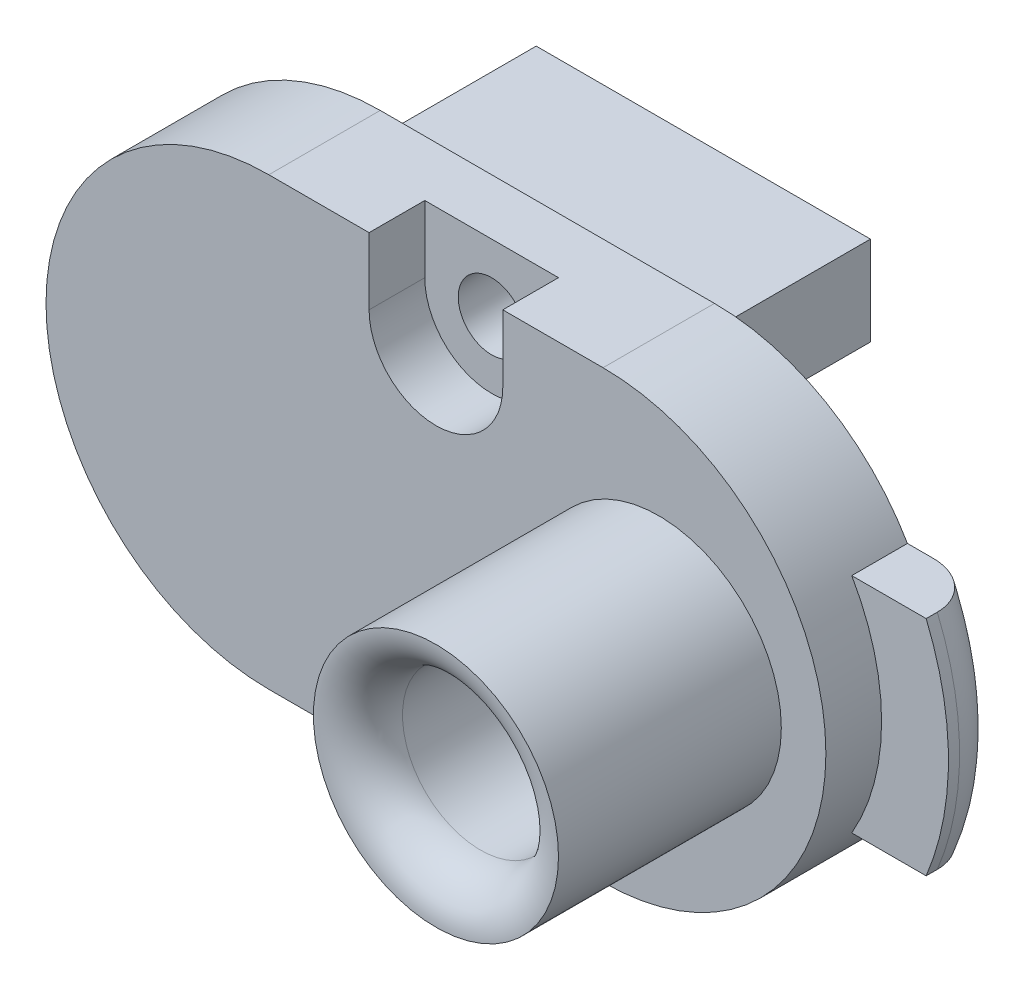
SolidWorks part; units mm, degrees
ref_plane "Face" through (0, 0, 0) normal (0, 0, 1) x (1, 0, 0)
ref_plane "Dessus" through (0, 0, 0) normal (0, 1, 0) x (1, 0, 0)
ref_plane "Droite" through (0, 0, 0) normal (1, 0, 0) x (0, 0, -1)
sketch "Esquisse1" plane through (0, 0, 0) normal (0, 0, 1) x (1, 0, 0)
  line L0 (-7.5, 0) -> (7.5, 0) construction
  line L1 (-7.5, 10) -> (7.5, 10)
  line L2 (-7.5, -10) -> (7.5, -10)
  arc A0 (7.5, -10) -> (7.5, 10) centre (7.5, 0) ccw
  arc A1 (-7.5, 10) -> (-7.5, -10) centre (-7.5, 0) ccw
  dimension "D1" = 35
  dimension "D2" = 10
extrude "Base-Extrusion" add sketch "Esquisse1" along normal mid plane 5
sketch "Esquisse3" plane through (0, 0, -2.5) normal (0, 0, -1) x (-1, 0, 0)
  line L0 (7.5, 9) -> (7.5, -9)
  line L1 (-7.5, -9) -> (-7.5, 9)
  line L14 (-7.5, -9) -> (7.5, -9)
  line L15 (7.5, 9) -> (-7.5, 9)
  line L16 (-7.5, -9) -> (7.5, -9)
  line L17 (7.5, 9) -> (-7.5, 9)
  arc A4 (-7.5, 9) -> (-7.5, -9) centre (-7.5, 0) ccw
  arc A5 (7.5, -9) -> (7.5, 9) centre (7.5, 0) ccw
  dimension "D1" = 1
extrude "Boss.-Extru.1" add sketch "Esquisse3" along normal blind 7
sketch "Esquisse2" plane through (0, 0, 2.5) normal (0, 0, 1) x (1, 0, 0)
  line L0 (3, -7) -> (3, -10)
  line L1 (-3, -7) -> (-3, -10)
  line L2 (0, -7) -> (0, 0) construction
  line L3 (-7.5, -10) -> (7.5, -10) construction
  line L4 (-3, -10) -> (3, -10)
  line L5 (0, 0) -> (14.475, 0) construction
  line L6 (-3, 10) -> (3, 10)
  line L7 (-3, 7) -> (-3, 10)
  line L8 (3, 7) -> (3, 10)
  arc A0 (3, 7) -> (-3, 7) centre (0, 7) cw
  arc A1 (3, -7) -> (-3, -7) centre (0, -7) ccw
  dimension "D1" = 6
  dimension "D2" = 3
extrude "Enlèv. mat.-Extru.1" cut sketch "Esquisse2" against normal blind 2.5
sketch "Esquisse4" plane through (0, 0, 0) normal (0, 0, 1) x (1, 0, 0)
  circle A0 centre (0, 7) radius 1.5
  circle A1 centre (0, -7) radius 1.5
  dimension "D1" = 3
extrude "Enlèv. mat.-Extru.2" cut sketch "Esquisse4" against normal through all
sketch "Esquisse5" plane through (0, 0, -9.5) normal (0, 0, -1) x (-1, 0, 0)
  line L0 (7.5, -9) -> (7.5, 9) construction
  line L1 (7.5, -5) -> (-7.5, -5)
  line L2 (7.5, -5) -> (7.5, 5)
  line L3 (7.5, 5) -> (-7.5, 5)
  line L4 (-7.5, -5) -> (-7.5, 5)
  line L5 (-7.5, 9) -> (-7.5, -9) construction
  line L6 (-7.5, 0) -> (0, 0) construction
  line L7 (-7.5, 10) -> (7.5, 10) construction
  dimension "D1" = 5
extrude "Enlèv. mat.-Extru.3" cut sketch "Esquisse5" against normal blind 5
sketch "Esquisse6" plane through (0, 0, -2.5) normal (0, 0, -1) x (-1, 0, 0)
  line L0 (7.5, -9) -> (7.5, 9) construction
  line L1 (7.5, -9) -> (7.5, -0.5)
  line L2 (7.5, 0.5) -> (16.4861, 0.5)
  line L3 (7.5, -0.5) -> (16.4861, -0.5)
  line L4 (7.5, 0.5) -> (7.5, 9)
  arc A0 (7.5, 9) -> (16.4861, 0.5) centre (7.5, 0) cw
  arc A1 (16.4861, -0.5) -> (7.5, -9) centre (7.5, 0) cw
  dimension "D1" = 1
extrude "Enlèv. mat.-Extru.5" cut sketch "Esquisse6" against normal blind 2
sketch "Esquisse7" plane through (0, 0, 2.5) normal (0, 0, 1) x (1, 0, 0)
  line L0 (0, 0) -> (10, 0) construction
  circle A0 centre (10, 0) radius 5.5
  arc A2 (7.5, -10) -> (7.5, 10) centre (7.5, 0) ccw construction
  dimension "D1" = 11
  dimension "D2" = 2
extrude "Boss.-Extru.2" add sketch "Esquisse7" along normal blind 10
sketch "Esquisse8" plane through (0, 0, 12.5) normal (0, 0, 1) x (1, 0, 0)
  circle A0 centre (10, 0) radius 3.5
  dimension "D1" = 7
extrude "Enlèv. mat.-Extru.6" cut sketch "Esquisse8" against normal through all
sketch "Esquisse9" plane through (0, 0, -9.5) normal (0, 0, -1) x (-1, 0, 0)
  circle A0 centre (-10, 0) radius 5.5
  dimension "D1" = 11
extrude "Enlèv. mat.-Extru.7" cut sketch "Esquisse9" against normal up to surface (7 mm away)
sketch "Esquisse10" plane through (0, 0, 0) normal (0, 0, 1) x (1, 0, 0)
  line L0 (16.1603, 5) -> (19.5, 5)
  line L1 (16.1603, -5) -> (19.5, -5)
  arc A0 (7.5, -10) -> (7.5, 10) centre (7.5, 0) ccw construction
  arc A1 (16.1603, -5) -> (16.1603, 5) centre (7.5, 0) ccw
  arc A2 (19.5, -5) -> (19.5, 5) centre (7.5, 0) ccw
  dimension "D3" = 26
  dimension "D1" = 10
  dimension "D2" = 5
extrude "Boss.-Extru.3" add sketch "Esquisse10" against normal blind 2.5
fillet "Congé1" radius 2 3 edges at (13.5, 0, -2.5) (13.5, 0, 12.5) (20.5, 0, -2.5)
